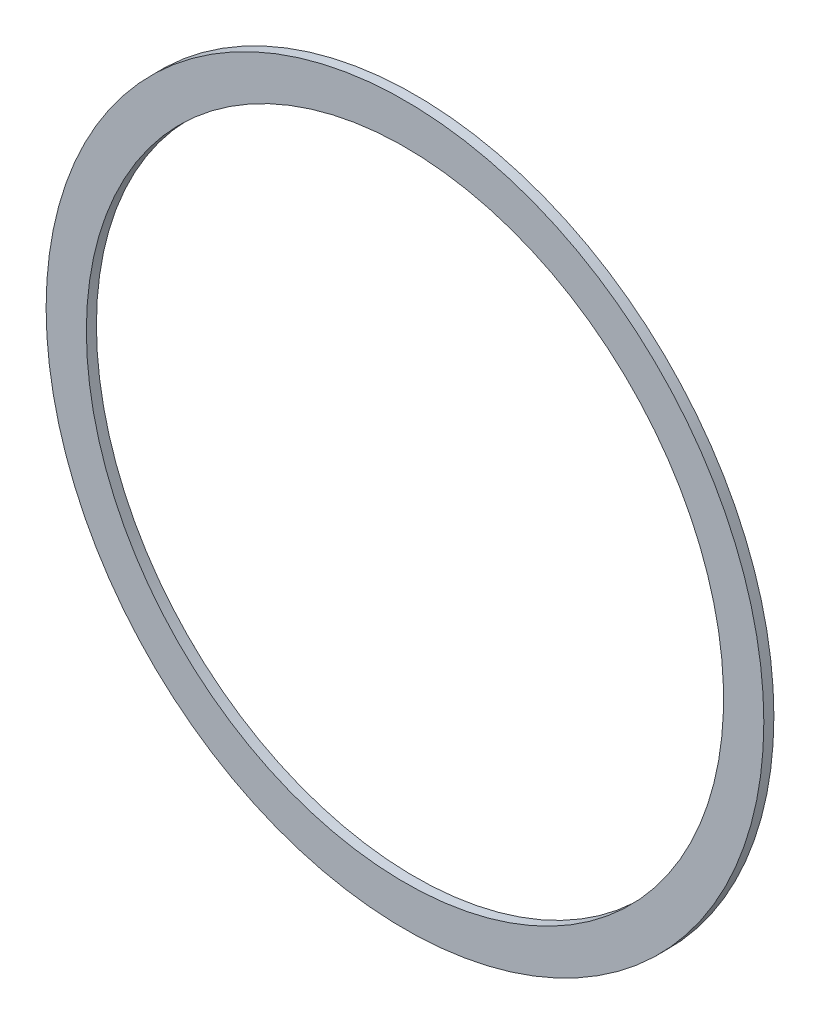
SolidWorks part; units mm, degrees
ref_plane "Front" through (0, 0, 0) normal (0, 0, 1) x (1, 0, 0)
ref_plane "Top" through (0, 0, 0) normal (0, 1, 0) x (1, 0, 0)
ref_plane "Right" through (0, 0, 0) normal (1, 0, 0) x (0, 0, -1)
sketch "Sketch1" plane through (0, 0, 0) normal (0, 0, 1) x (1, 0, 0)
  circle A0 centre (0, 0) radius 24.13
  circle A1 centre (0, 0) radius 27.178
  dimension "D1" = 48.26
  dimension "D2" = 54.356
extrude "Base-Extrude" add sketch "Sketch1" along normal blind 0.762
